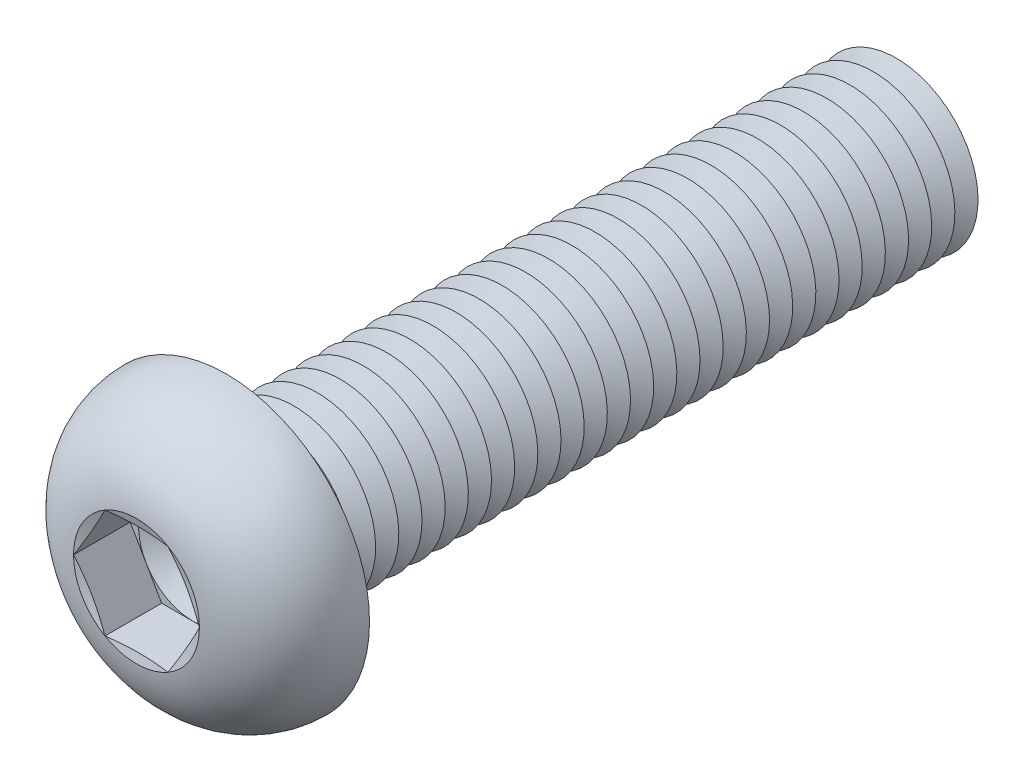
SolidWorks part; units mm, degrees
ref_plane "Front Plane" through (0, 0, 0) normal (0, 0, 1) x (1, 0, 0)
ref_plane "Top Plane" through (0, 0, 0) normal (0, 1, 0) x (1, 0, 0)
ref_plane "Right Plane" through (0, 0, 0) normal (1, 0, 0) x (0, 0, -1)
sketch "Sketch1" plane through (0, 0, 0) normal (1, 0, 0) x (0, 0, -1)
  line L0 (0, 6) -> (0, 10.5)
  line L3 (0, 6) -> (50, 6)
  line L4 (50, 6) -> (50, 0)
  line L5 (50, 0) -> (-6.6, 0) construction
  line L6 (-6.6, 0) -> (50, 0)
  line L7 (-6.6, 4.6188) -> (-6.6, 2.3094) construction
  line L8 (-6.6, 2.3094) -> (-6.6, 0)
  line L9 (-6.6, 4.6188) -> (-5.9812, 2.3094)
  line L10 (-5.9812, 2.3094) -> (-6.6, 2.3094)
  line L11 (50, 0) -> (22.7481, 0) construction
  line L12 (0, 10.5) -> (-6.6, 10.5) construction
  arc A1 (0, 10.5) -> (-6.6, 4.6188) centre (0, 3.8561) ccw
  point P8 (50, 3)
  dimension "D1" = 21
  dimension "D2" = 12
  dimension "D3" = 6.6
  dimension "D4" = 9.2376
  dimension "D5" = 50
  dimension "D6" = 15
revolve "Revolve1" add sketch "Sketch1" angle 360 about L5
fillet "Fillet1" radius 0.85 1 edges at (0, 6, 0)
sketch "Sketch2" plane through (0, 0, 0) normal (1, 0, 0) x (0, 0, -1)
  line L0 (49.15, 6) -> (50.85, 6)
  line L1 (50, 6) -> (0.85, 6) construction
  line L2 (50.85, 6) -> (50, 4.5278)
  line L3 (50, -6) -> (50, 6) construction
  line L4 (50, 4.5278) -> (49.15, 6)
  dimension "D1" = 1.7
revolve "Cut-Revolve1" cut sketch "Sketch2" angle 360 about axis through (0, 0, -50) along (0, 0, -1)
pattern_linear "LPattern1" count 29 spacing 1.7 along (0, 0, 1) of "Cut-Revolve1"
sketch "Sketch3" plane through (0, 0, 6.6) normal (0, 0, 1) x (1, 0, 0)
  line L7 (2.3094, 4) -> (-2.3094, 4)
  line L8 (-2.3094, 4) -> (-4.6188, 0)
  line L9 (-4.6188, 0) -> (-2.3094, -4)
  line L10 (-2.3094, -4) -> (2.3094, -4)
  line L11 (2.3094, -4) -> (4.6188, 0)
  line L12 (4.6188, 0) -> (2.3094, 4)
  circle A0 centre (0, 0) radius 4 construction
  circle A3 centre (0, 0) radius 4.6188 construction
extrude "Cut-Extrude1" cut sketch "Sketch3" against normal blind 4.16
sketch "Sketch4" plane through (0, 0, 2.44) normal (0, 0, 1) x (1, 0, 0)
  line L1 (2.3094, 4) -> (-2.3094, 4) construction
  circle A0 centre (0, 0) radius 4
extrude "Cut-Extrude2" cut sketch "Sketch4" against normal through all draft 60
